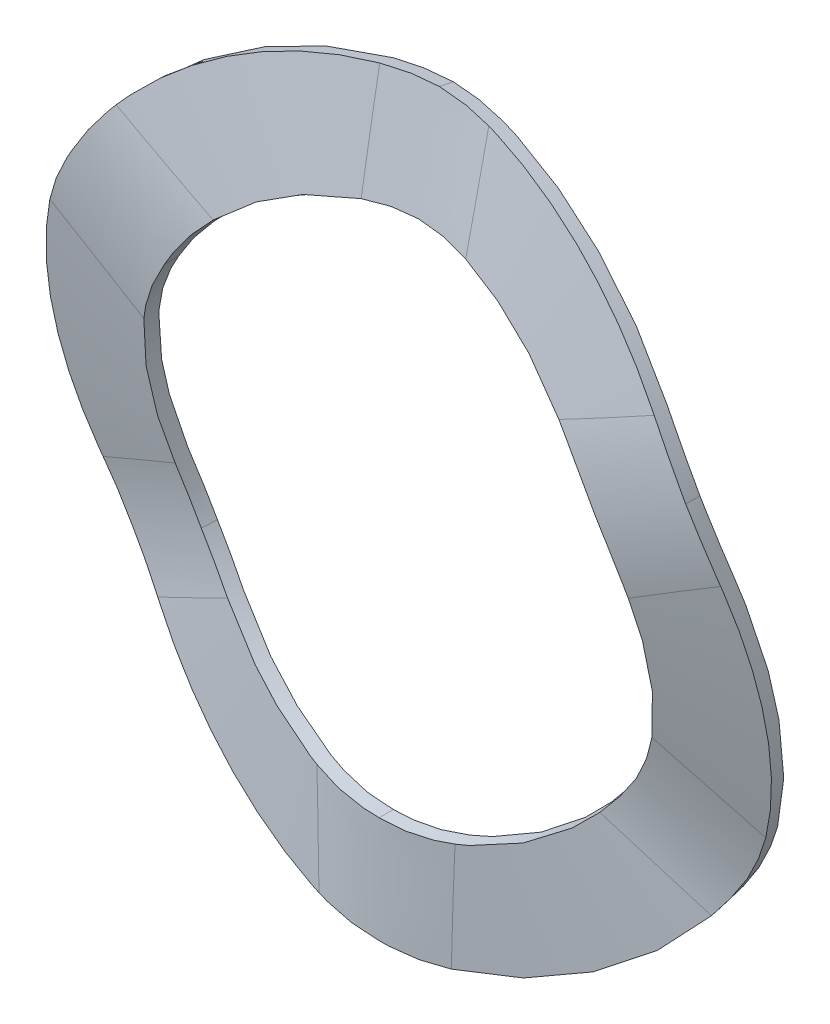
SolidWorks part; units mm, degrees
ref_plane "Plan de face" through (0, 0, 0) normal (0, 0, 1) x (1, 0, 0)
ref_plane "Plan de dessus" through (0, 0, 0) normal (0, 1, 0) x (1, 0, 0)
ref_plane "Plan de droite" through (0, 0, 0) normal (1, 0, 0) x (0, 0, -1)
sketch "Esquisse1" plane through (0, 0, 0) normal (0, 0, 1) x (1, 0, 0)
  line L0 (0, 0) -> (0, 12.9298) construction
  line L1 (0, 0) -> (12.1535, -7.0168) construction
  line L2 (0, 0) -> (-11.1987, -6.4656) construction
  circle A0 centre (0, 0) radius 10
  point P3 (0, 10)
  point P7 (8.6766, -4.9717)
  point P8 (-8.6603, -5)
  dimension "D1" = 20
  dimension "D2" = 120
  dimension "D3" = 120
ref_plane "Plan1" through (0, 0, 2) normal (0, 0, 1) x (1, 0, 0)
sketch "Esquisse2" plane through (0, 0, 2) normal (0, 0, 1) x (1, 0, 0)
  line L0 (0, 0) -> (0, -10) construction
  line L1 (0, -10) -> (0, 0) construction
  line L2 (0, 0) -> (-10.9573, 6.3262) construction
  line L4 (0, 0) -> (11.7886, 6.8062) construction
  circle A0 centre (0, 0) radius 10
  point P4 (-8.6603, 5)
  point P8 (8.6603, 5)
  dimension "D1" = 120
  dimension "D2" = 120
sketch "Esquisse3" plane through (0, 0, 0) normal (0, 1, 0) x (1, 0, 0)
  line L0 (0, 0) -> (0, -2) construction
  point P4 (0, -1)
sketch3d "Esquisse3D3"
  arc A0 (-8.6603, -5, 0) -> (-8.6603, 5, 2) centre (0, 0, 1) cw
  arc A1 (-8.6603, 5, 2) -> (0, 10, 0) centre (0, 0, 1) cw
  arc A2 (0, 10, 0) -> (8.6603, 5, 2) centre (0, 0, 1) cw
  arc A3 (8.6603, 5, 2) -> (8.6766, -4.9717, 0) centre (0, 0, 1) ccw
  arc A4 (8.6766, -4.9717, 0) -> (0, -10, 2) centre (0, 0, 1) cw
  arc A6 (0, -10, 2) -> (-8.6603, -5, 0) centre (0, 0, 1) cw
  point P2 (0, 1.9709, -8.8547)
  point P8 (-1.7069, -0.9855, -8.8547)
  point P11 (1.7069, -0.9855, -8.8547)
  point P14 (-0.0032, 1.9763, -8.8536)
  point P17 (-1.7006, -0.9856, -8.8558)
  point P21 (1.7069, -0.9855, -8.8547)
sketch "Esquisse4" plane through (0, 0, 0) normal (1, 0, 0) x (0, 0, -1)
  line L0 (0, 0) -> (-2, 0) construction
  line L1 (-2, -10) -> (-1.6, -10)
  line L2 (-2, -10) -> (-2, -7)
  line L3 (-2, -7) -> (-1.6, -7)
  line L4 (-1.6, -10) -> (-1.6, -7)
  dimension "D1" = 7
  dimension "D2" = 0.4
sweep "Balayage1" add profiles "Esquisse4" path "Esquisse3D3"
fillet "Congé1" radius 10 12 edges at (7.6375, -4.376, -0.1662) (0, -8.8589, 1.6) (-7.3183, -4.2252, -0.0951) (-7.3612, 4.25, 1.6) (0, 8.4505, -0.0951) (7.3612, 4.2501, 1.6) (0, -7.8515, 2) (7.2113, -4.1322, 0.3412)
